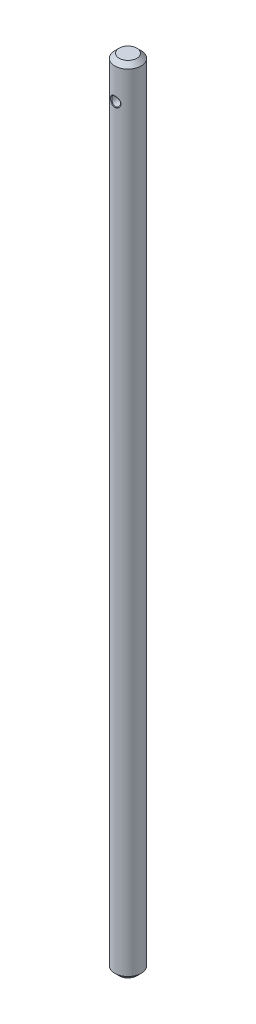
SolidWorks part; units mm, degrees
ref_plane "Plan de face" through (0, 0, 0) normal (0, 0, 1) x (1, 0, 0)
ref_plane "Plan de dessus" through (0, 0, 0) normal (0, 1, 0) x (1, 0, 0)
ref_plane "Plan de droite" through (0, 0, 0) normal (1, 0, 0) x (0, 0, -1)
sketch "Esquisse1" plane through (0, 0, 0) normal (0, 0, 1) x (1, 0, 0)
  line L0 (0, 0) -> (-1, 0)
  line L1 (-1.5, 0.5) -> (-1.5, 89.5)
  line L2 (-1, 90) -> (0, 90)
  line L3 (0, 90) -> (0, 0) construction
  line L4 (-1.5, 89.5) -> (-1, 90)
  line L5 (-1, 0) -> (-1.5, 0.5)
  line L6 (0, 0) -> (0, 90)
  point P1 (-1.5, 0)
  point P4 (-1.5, 90)
  dimension "D1" = 0.5
  dimension "D2" = 45
  dimension "D3" = 45
revolve "Révolution1" add sketch "Esquisse1" angle 360 about L3
sketch "Esquisse2" plane through (0, 0, 0) normal (0, 0, 1) x (1, 0, 0)
  line L0 (0, 63.55) -> (0, 53.4065) construction
  line L1 (1, 90) -> (-1, 90) construction
  circle A0 centre (0, 86) radius 0.5
  dimension "D1" = 1
  dimension "D2" = 4
extrude "Enlèv. mat.-Extru.1" cut sketch "Esquisse2" against normal mid plane 10
chamfer "Chanfrein1" distance 0.1 angle 45 2 edges at (-0.4926, 86.0854, -1.4168) (-0.4926, 85.9146, 1.4168)
equation "\"D1@Esquisse1\" = \"D\"/6"
